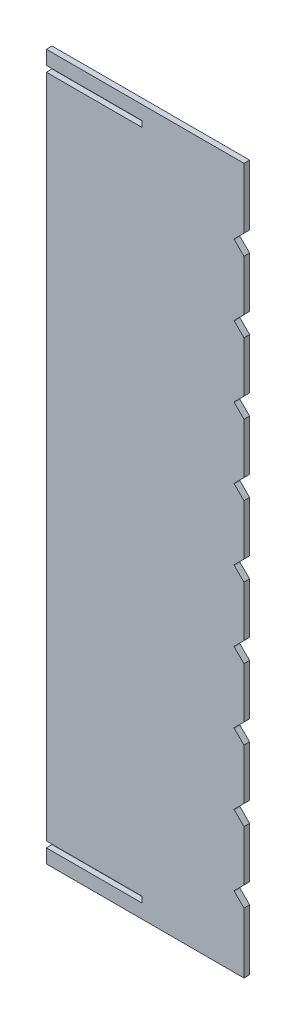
SolidWorks part; units mm, degrees
ref_plane "Спереди" through (0, 0, 0) normal (0, 0, 1) x (1, 0, 0)
ref_plane "Сверху" through (0, 0, 0) normal (0, 1, 0) x (1, 0, 0)
ref_plane "Справа" through (0, 0, 0) normal (1, 0, 0) x (0, 0, -1)
sketch "Model" plane through (0, 0, 0) normal (0, 0, 1) x (1, 0, 0)
  line L0 (-2502.5465, -558.8025) -> (-2502.5465, -594.6603)
  line L1 (-2502.5465, -594.6603) -> (-2502.8805, -594.9941)
  line L2 (-2502.8805, -594.9941) -> (-2503.2562, -595.3699)
  line L3 (-2503.2562, -595.3699) -> (-2509.6178, -601.7314)
  line L4 (-2509.6178, -601.7314) -> (-2509.2838, -602.0653)
  line L5 (-2509.2838, -602.0653) -> (-2502.5465, -608.8025)
  line L6 (-2502.5465, -608.8025) -> (-2502.5465, -644.6603)
  line L7 (-2502.5465, -644.6603) -> (-2502.8805, -644.9941)
  line L8 (-2502.8805, -644.9941) -> (-2503.2562, -645.3699)
  line L9 (-2503.2562, -645.3699) -> (-2509.6178, -651.7314)
  line L10 (-2509.6178, -651.7314) -> (-2509.2838, -652.0653)
  line L11 (-2509.2838, -652.0653) -> (-2502.5465, -658.8025)
  line L12 (-2502.5465, -658.8025) -> (-2502.5465, -694.6603)
  line L13 (-2502.5465, -694.6603) -> (-2502.8805, -694.9941)
  line L14 (-2502.8805, -694.9941) -> (-2503.2562, -695.3699)
  line L15 (-2503.2562, -695.3699) -> (-2509.6178, -701.7314)
  line L16 (-2509.6178, -701.7314) -> (-2509.2838, -702.0653)
  line L17 (-2509.2838, -702.0653) -> (-2502.5465, -708.8025)
  line L18 (-2502.5465, -708.8025) -> (-2502.5465, -744.6603)
  line L19 (-2502.5465, -744.6603) -> (-2502.8805, -744.9941)
  line L20 (-2502.8805, -744.9941) -> (-2503.2562, -745.3699)
  line L21 (-2503.2562, -745.3699) -> (-2509.6178, -751.7314)
  line L22 (-2509.6178, -751.7314) -> (-2509.2838, -752.0653)
  line L23 (-2509.2838, -752.0653) -> (-2502.5465, -758.8025)
  line L24 (-2502.5465, -758.8025) -> (-2502.5465, -794.6604)
  line L25 (-2502.5465, -794.6604) -> (-2502.8805, -794.9943)
  line L26 (-2502.8805, -794.9943) -> (-2509.6178, -801.7314)
  line L27 (-2509.6178, -801.7314) -> (-2509.2838, -802.0654)
  line L28 (-2509.2838, -802.0654) -> (-2502.5465, -808.8025)
  line L29 (-2502.5465, -808.8025) -> (-2502.5465, -844.6604)
  line L30 (-2502.5465, -844.6604) -> (-2502.8805, -844.9943)
  line L31 (-2502.8805, -844.9943) -> (-2509.6178, -851.7314)
  line L32 (-2509.6178, -851.7314) -> (-2509.2838, -852.0654)
  line L33 (-2509.2838, -852.0654) -> (-2502.5465, -858.8025)
  line L34 (-2502.5465, -858.8025) -> (-2502.5465, -901.7314)
  line L35 (-2502.5465, -901.7314) -> (-2642.5468, -901.7314)
  line L36 (-2642.5468, -901.7314) -> (-2642.5468, -891.8314)
  line L37 (-2642.5468, -891.8314) -> (-2574.8947, -891.8314)
  line L38 (-2574.8947, -891.8314) -> (-2574.8947, -891.7314)
  line L39 (-2574.8947, -891.7314) -> (-2574.8947, -887.7314)
  line L40 (-2574.8947, -887.7314) -> (-2574.8947, -887.6314)
  line L41 (-2574.8947, -887.6314) -> (-2642.5468, -887.6314)
  line L42 (-2642.5468, -887.6314) -> (-2642.5468, -415.8314)
  line L43 (-2642.5468, -415.8314) -> (-2574.8949, -415.8314)
  line L44 (-2574.8949, -415.8314) -> (-2574.8949, -415.7314)
  line L45 (-2574.8949, -415.7314) -> (-2574.8949, -411.7314)
  line L46 (-2574.8949, -411.7314) -> (-2574.8949, -411.6314)
  line L47 (-2574.8949, -411.6314) -> (-2642.5468, -411.6314)
  line L48 (-2642.5468, -411.6314) -> (-2642.5468, -401.7314)
  line L49 (-2642.5468, -401.7314) -> (-2502.5465, -401.7314)
  line L50 (-2502.5465, -401.7314) -> (-2502.5465, -444.6604)
  line L51 (-2502.5465, -444.6604) -> (-2502.8805, -444.9943)
  line L52 (-2502.8805, -444.9943) -> (-2509.6178, -451.7314)
  line L53 (-2509.6178, -451.7314) -> (-2509.2838, -452.0654)
  line L54 (-2509.2838, -452.0654) -> (-2502.5465, -458.8025)
  line L55 (-2502.5465, -458.8025) -> (-2502.5465, -494.6604)
  line L56 (-2502.5465, -494.6604) -> (-2502.8805, -494.9943)
  line L57 (-2502.8805, -494.9943) -> (-2509.6178, -501.7314)
  line L58 (-2509.6178, -501.7314) -> (-2509.2838, -502.0654)
  line L59 (-2509.2838, -502.0654) -> (-2502.5465, -508.8025)
  line L60 (-2502.5465, -508.8025) -> (-2502.5465, -544.6603)
  line L61 (-2502.5465, -544.6603) -> (-2502.8805, -544.9941)
  line L62 (-2502.8805, -544.9941) -> (-2503.2562, -545.3699)
  line L63 (-2503.2562, -545.3699) -> (-2509.6178, -551.7314)
  line L64 (-2509.6178, -551.7314) -> (-2509.2838, -552.0653)
  line L65 (-2509.2838, -552.0653) -> (-2502.5465, -558.8025)
extrude "Бобышка-Вытянуть1" add sketch "Model" along normal blind 4
